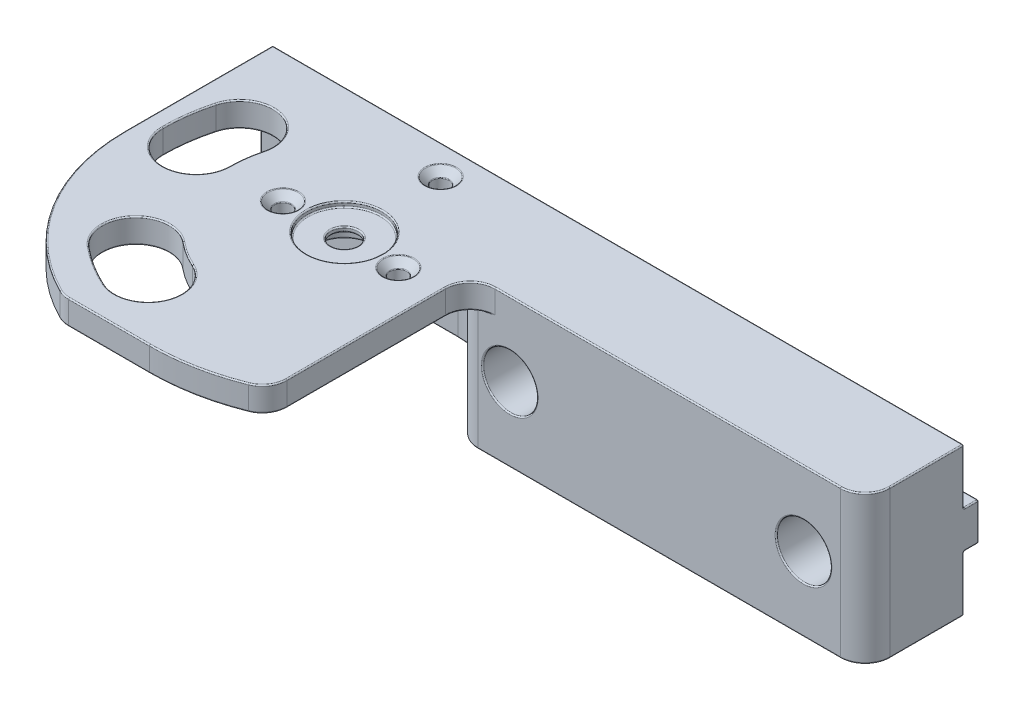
SolidWorks part; units mm, degrees
ref_plane "Plan de face" through (0, 0, 0) normal (0, 0, 1) x (1, 0, 0)
ref_plane "Plan de dessus" through (0, 0, 0) normal (0, 1, 0) x (1, 0, 0)
ref_plane "Plan de droite" through (0, 0, 0) normal (1, 0, 0) x (0, 0, -1)
sketch "Esquisse1" plane through (0, 0, 0) normal (0, 0, 1) x (1, 0, 0)
  line L1 (0, 0) -> (150, 0)
  line L2 (0, 0) -> (0, 30)
  line L3 (0, 30) -> (150, 30)
  line L4 (150, 0) -> (150, 30)
  dimension "D1" = 30
  dimension "D2" = 150
extrude "Boss.-Extru.1" add sketch "Esquisse1" along normal blind 65
sketch "Esquisse2" plane through (0, 0, 0) normal (0, 0, -1) x (-1, 0, 0)
  line L0 (-150, 15) -> (0, 15) construction
  line L1 (-150, 0) -> (-150, 30) construction
  line L2 (0, 30) -> (0, 0) construction
  line L4 (-150, 18.8) -> (0, 18.8)
  line L5 (-150, 18.8) -> (-150, 11.2)
  line L6 (-150, 11.2) -> (0, 11.2)
  line L7 (0, 18.8) -> (0, 11.2)
  dimension "D1" = 7.6
extrude "Boss.-Extru.2" add sketch "Esquisse2" along normal blind 3
hole_wizard "Chambrage pour vis à six pans creux M61" positions "Esquisse3" profile "Esquisse4" counterbore size "M6" standard "ISO"
sketch "Esquisse3" plane through (0, 0, 65) normal (0, 0, 1) x (1, 0, 0)
  line L0 (0, 15) -> (150, 15) construction
  line L1 (0, 30) -> (0, 0) construction
  line L2 (150, 0) -> (150, 30) construction
  line L4 (75, 30) -> (75, 0) construction
  line L5 (150, 30) -> (0, 30) construction
  line L6 (0, 0) -> (150, 0) construction
  point P0 (78, 15)
  point P2 (137.5, 15)
  dimension "D1" = 12.5
  dimension "D2" = 72
sketch "Esquisse4" plane through (78, 15, 65) normal (1, 0, 0) x (0, -1, 0)
  line L0 (0, 0) -> (0, 68)
  line L1 (0, 68) -> (3.3, 68)
  line L3 (3.3, 68) -> (3.3, 60)
  line L4 (3.3, 60) -> (5.5, 60)
  line L5 (5.5, 60) -> (5.5, 0)
  line L7 (5.5, 0) -> (0, 0)
  line L11 (0, -6.35) -> (0, 107.95) construction
  dimension "Diamètre du perçage jusqu'au prochain" = 6.6
  dimension "Profondeur du perçage jusqu'au prochain" = 68
  dimension "Diamètre du chambrage" = 11
  dimension "Profondeur du chambrage" = 60
sketch "Esquisse5" plane through (0, 0, 0) normal (0, -1, 0) x (1, 0, 0)
  line L0 (150, -3) -> (0, -3) construction
  line L2 (0, 65) -> (0, 0) construction
  circle A0 centre (50, 19.5) radius 17
  dimension "D1" = 34
  dimension "D2" = 22.5
  dimension "D3" = 50
extrude "Enlèv. mat.-Extru.1" cut sketch "Esquisse5" against normal offset from surface (25 mm away) 5
hole_wizard "Fraisage pour vis à tête fraisée M31" positions "Esquisse7" profile "Esquisse8" countersink size "M3" standard "ISO"
sketch "Esquisse7" plane through (0, 30, 0) normal (0, 1, 0) x (1, 0, 0)
  line L0 (50, -6) -> (50, -19.5) construction
  line L1 (50, -19.5) -> (61.6913, -26.25) construction
  line L3 (38.3087, -26.25) -> (50, -19.5) construction
  circle A0 centre (50, -19.5) radius 13.5 construction
  point P0 (38.3087, -26.25)
  point P2 (50, -6)
  point P4 (61.6913, -26.25)
  point P31 (0, 0)
  point P32 (50, -33)
  point P33 (52.7302, -6.279)
  point P34 (0, 0)
  point P35 (50, -6)
  point P36 (50, -6)
  dimension "D1" = 27
  dimension "D2" = 120
  dimension "D3" = 120
sketch "Esquisse8" plane through (38.3087, 30, 26.25) normal (1, 0, 0) x (0, 0, 1)
  line L0 (0, 0) -> (0, 30)
  line L1 (0, 30) -> (1.7, 30)
  line L2 (1.7, 30) -> (1.7, 1.45)
  line L3 (1.7, 1.45) -> (3.15, 0)
  line L5 (3.15, 0) -> (0, 0)
  line L6 (-1.7, 1.45) -> (-3.15, 0) construction
  line L11 (0, -6.35) -> (0, 107.95) construction
  dimension "Diamètre du perçage jusqu'au prochain" = 3.4
  dimension "Profondeur du perçage jusqu'au prochain" = 30
  dimension "Diamètre du fraisage entrant" = 6.3
  dimension "Angle du fraisage entrant" = 90
sketch "Esquisse9" plane through (0, 25, 0) normal (0, -1, 0) x (1, 0, 0)
  circle A0 centre (50, 25.5) radius 5.5
  circle A1 centre (50, 19.5) radius 17 construction
  point P2 (50, 19.5)
  dimension "D1" = 11
  dimension "D2" = 6
extrude "Enlèv. mat.-Extru.2" cut sketch "Esquisse9" against normal blind 3
hole_wizard "Dégagement M51" positions "Esquisse10" profile "Esquisse11" hole size "M5" standard "ISO"
sketch "Esquisse10" plane through (0, 30, 0) normal (0, 1, 0) x (1, 0, 0)
  point P0 (50, -25.5)
sketch "Esquisse11" plane through (50, 30, 25.5) normal (1, 0, 0) x (0, 0, 1)
  line L0 (0, 0) -> (0, 30)
  line L1 (0, 30) -> (2.75, 30)
  line L2 (2.75, 30) -> (2.75, 0)
  line L5 (2.75, 0) -> (0, 0)
  line L11 (0, -6.35) -> (0, 107.95) construction
  dimension "Diamètre du perçage jusqu'au prochain" = 5.5
  dimension "Profondeur du perçage jusqu'au prochain" = 30
hole_wizard "Dégagement M121" positions "Esquisse12" profile "Esquisse13" hole size "M12" standard "ISO"
sketch "Esquisse12" plane through (0, 30, 0) normal (0, 1, 0) x (1, 0, 0)
  line L0 (20, -25.5) -> (50, -25.5) construction
  line L1 (50, -25.5) -> (34.1024, -50.9414) construction
  line L2 (50, -25.5) -> (21.0222, -17.7354) construction
  line L3 (50, -25.5) -> (50, 0) construction
  line L4 (150, 0) -> (0, 0) construction
  point P2 (34.1024, -50.9414)
  point P22 (21.0222, -17.7354)
  point P35 (50, -16.8399)
  dimension "D1" = 58
  dimension "D2" = 30
  dimension "D3" = 15
  dimension "D4" = 0
sketch "Esquisse13" plane through (34.1024, 30, 50.9414) normal (1, 0, 0) x (0, 0, 1)
  line L0 (0, 0) -> (0, 30)
  line L1 (0, 30) -> (6.75, 30)
  line L2 (6.75, 30) -> (6.75, 0)
  line L5 (6.75, 0) -> (0, 0)
  line L11 (0, -6.35) -> (0, 107.95) construction
  dimension "Diamètre du perçage jusqu'au prochain" = 13.5
  dimension "Profondeur du perçage jusqu'au prochain" = 30
sketch "Esquisse24" plane through (0, 30, 0) normal (0, 1, 0) x (1, 0, 0)
  line L0 (50, -25.5) -> (21.0222, -17.7354) construction
  line L1 (21.0222, -17.7354) -> (37.5592, -52.7988) construction
  line L2 (37.5592, -52.7988) -> (50, -25.5) construction
  line L3 (20, -25.5) -> (50, -25.5) construction
  arc A0 (21.0222, -17.7354) -> (37.5592, -52.7988) centre (50, -25.5) ccw construction
  arc A1 (21.0222, -17.7354) -> (20, -25.5) centre (50, -25.5) ccw construction
  arc A2 (14.5022, -15.9884) -> (13.25, -25.5) centre (50, -25.5) ccw
  arc A3 (27.5422, -19.4825) -> (26.75, -25.5) centre (50, -25.5) ccw
  arc A4 (27.5422, -19.4825) -> (14.5022, -15.9884) centre (21.0222, -17.7354) ccw
  arc A5 (13.25, -25.5) -> (26.75, -25.5) centre (20, -25.5) ccw
  circle A6 centre (21.0222, -17.7354) radius 6.75 construction
  arc A7 (37.5592, -52.7988) -> (30.9177, -48.6487) centre (50, -25.5) cw construction
  arc A8 (26.6241, -53.8572) -> (34.76, -58.9411) centre (50, -25.5) ccw
  arc A9 (35.2112, -43.4403) -> (40.3584, -46.6566) centre (50, -25.5) ccw
  arc A10 (35.2112, -43.4403) -> (26.6241, -53.8572) centre (30.9177, -48.6487) ccw
  arc A11 (34.76, -58.9411) -> (40.3584, -46.6566) centre (37.5592, -52.7988) ccw
  circle A12 centre (34.1024, -50.9414) radius 6.75 construction
  point P7 (20.2567, -21.5842)
  point P13 (34.1024, -50.9414)
  point P23 (0, 0)
  point P24 (0, 0)
  point P25 (56.7324, -54.7348)
extrude "Enlèv. mat.-Extru.12" cut sketch "Esquisse24" against normal through all
sketch "Esquisse21" plane through (0, 30, 0) normal (0, 1, 0) x (1, 0, 0)
  circle A0 centre (50, -25.5) radius 7.6
  dimension "D1" = 15.2
extrude "Enlèv. mat.-Extru.11" cut sketch "Esquisse21" against normal blind 1
sketch "Esquisse14" plane through (0, 30, 0) normal (0, 1, 0) x (1, 0, 0)
  line L0 (150, -65) -> (150, 0) construction
  line L1 (150, -20) -> (70, -20)
  line L2 (150, -20) -> (150, -65)
  line L3 (150, -65) -> (70, -65)
  line L4 (70, -20) -> (70, -65)
  line L5 (150, -65) -> (0, -65) construction
  dimension "D1" = 45
  dimension "D2" = 80
extrude "Enlèv. mat.-Extru.3" cut sketch "Esquisse14" against normal up to surface (30 mm away)
sketch "Esquisse15" plane through (0, 0, 0) normal (-1, 0, 0) x (0, 0, 1)
  line L1 (-21.0739, 41.6485) -> (61.184, 41.6485)
  line L2 (-21.0739, 41.6485) -> (-21.0739, -14.4014)
  line L3 (-21.0739, -14.4014) -> (61.184, -14.4014)
  line L4 (61.184, 41.6485) -> (61.184, -14.4014)
extrude "Enlèv. mat.-Extru.4" cut sketch "Esquisse15" against normal blind 10
sketch "Esquisse19" plane through (0, 0, 0) normal (0, -1, 0) x (1, 0, 0)
  line L0 (10, 61.184) -> (10, 0) construction
  line L1 (70, 65) -> (0, 65) construction
  line L2 (50, 65) -> (50, 25.5) construction
  line L4 (70, 20) -> (70, 65) construction
  line L5 (70, 60.3687) -> (70, 65)
  line L6 (70, 65) -> (50, 65)
  line L7 (10, 30) -> (10, 61.184)
  line L8 (0, 65) -> (32.5, 65)
  line L9 (0, 65) -> (70, 65) construction
  line L10 (10, 0) -> (10, 61.184) construction
  line L13 (0, 65) -> (0, 61.184)
  line L14 (0, 61.184) -> (10, 61.184)
  arc A1 (10, 30) -> (32.5, 65) centre (48.4722, 30) cw
  arc A2 (70, 60.3687) -> (50, 65) centre (50, 19.5) ccw
  circle A3 centre (50, 19.5) radius 17 construction
  point P3 (0.6723, 65)
  dimension "D1" = 35
  dimension "D2" = 32.5
extrude "Enlèv. mat.-Extru.9" cut sketch "Esquisse19" against normal through all
sketch "Esquisse20" plane through (0, 25, 0) normal (0, -1, 0) x (1, 0, 0)
  line L0 (50, 2.5) -> (10, 2.5)
  line L1 (10, 0) -> (10, 30) construction
  line L2 (10, 2.5) -> (10, 65)
  line L3 (10, 65) -> (70, 65)
  line L7 (50, 20) -> (50, 2.5)
  line L8 (70, 20) -> (50, 20)
  line L9 (32.5, 65) -> (50, 65) construction
  line L10 (70, 20) -> (70, 65)
  line L11 (50, 19.5) -> (50, 2.5) construction
  circle A0 centre (50, 19.5) radius 17 construction
  circle A1 centre (50, 19.5) radius 17 construction
extrude "Enlèv. mat.-Extru.10" cut sketch "Esquisse20" along normal up to surface (25 mm away)
fillet "Congé3" radius 5 3 edges at (70, 27.5, 20) (32.5, 27.5, 65) (70, 27.5, 60.3687)
fillet "Congé4" radius 5 2 edges at (66.9926, 12.5, 20) (150, 15, 20)
fillet "Congé6" radius 10 1 edges at (10, 0, 1.25)
fillet "Congé5" radius 0.25 87 edges at (73.2674, 25, 20) (70, 30, 41.0599) (70, 25, 41.0599) (41.8133, 30, 65) (41.8133, 25, 65) (10, 25, 16.25) (30, 25, 2.5) (10, 17.5, 2.5) (35, 0, 2.5) (15.7876, 25, 50.2935) (15.7876, 30, 50.2935) (22.7693, 25, 11.2154) (22.7693, 30, 11.2154) (58.5798, 30, 64.1837) (10, 18.8, -1.5) (10, 11.2, -1.5) (10, 10.6, 0) (10, 24.4, 0) (10, 30, 15) (110, 30, 20) (108.2674, 0, 20) (72.5, 15, 20) (132, 15, 20) (50, 30, 33.1) (50, 29, 33.1) (50, 29, 28.25) (50, 28, 22.75) (50, 28, 20) (50, 25, 20) (38.3087, 30, 29.4) (38.3087, 28.55, 27.95) (38.3087, 25, 24.55) (50, 30, 9.15) (50, 28.55, 7.7) (50, 25, 4.3) (61.6913, 30, 29.4) (61.6913, 28.55, 27.95) (61.6913, 25, 24.55) (60.7212, 0, 6.3069) (60.7212, 25, 6.3069) (83.5, 15, 5) (81.3, 15, 5) (81.3, 15, -3) (143, 15, 5) (140.8, 15, 5) (140.8, 15, -3) (80, 11.2, 0) (80, 18.8, 0) (150, 15, -3) (80, 11.2, -3) (80, 18.8, -3) (150, 18.8, -1.5) (150, 11.2, -1.5) (85, 0, 0) (150, 24.4, 0) (150, 5.6, 0) (80, 30, 0) (150, 30, 7.5) (150, 0, 7.5) (10, 15, -3) (58.5798, 25, 64.1837) (69.1388, 30, 59.9252) (69.1388, 25, 59.9252) (32.488, 30, 64.8686) (32.488, 25, 64.8686) (71.4645, 30, 21.4645) (71.4645, 25, 21.4645) (148.5355, 30, 18.5355) (68.3816, 0, 18.8803) (148.5355, 0, 18.5355) (68.3816, 25, 18.8803) (37.6794, 25, 45.2171) (37.6794, 30, 45.2171) (25.7092, 25, 44.3552) (25.7092, 30, 44.3552) (30.5255, 25, 56.6658) (30.5255, 30, 56.6658) (13.5644, 25, 20.7032) (13.5644, 30, 20.7032) (20, 25, 32.25) (20, 30, 32.25) (26.9489, 25, 22.4653) (26.9489, 30, 22.4653) (12.9289, 2.9289, 0) (12.9289, 2.9289, 2.5) (43.7014, 30, 55.598) (43.7014, 25, 55.598)
